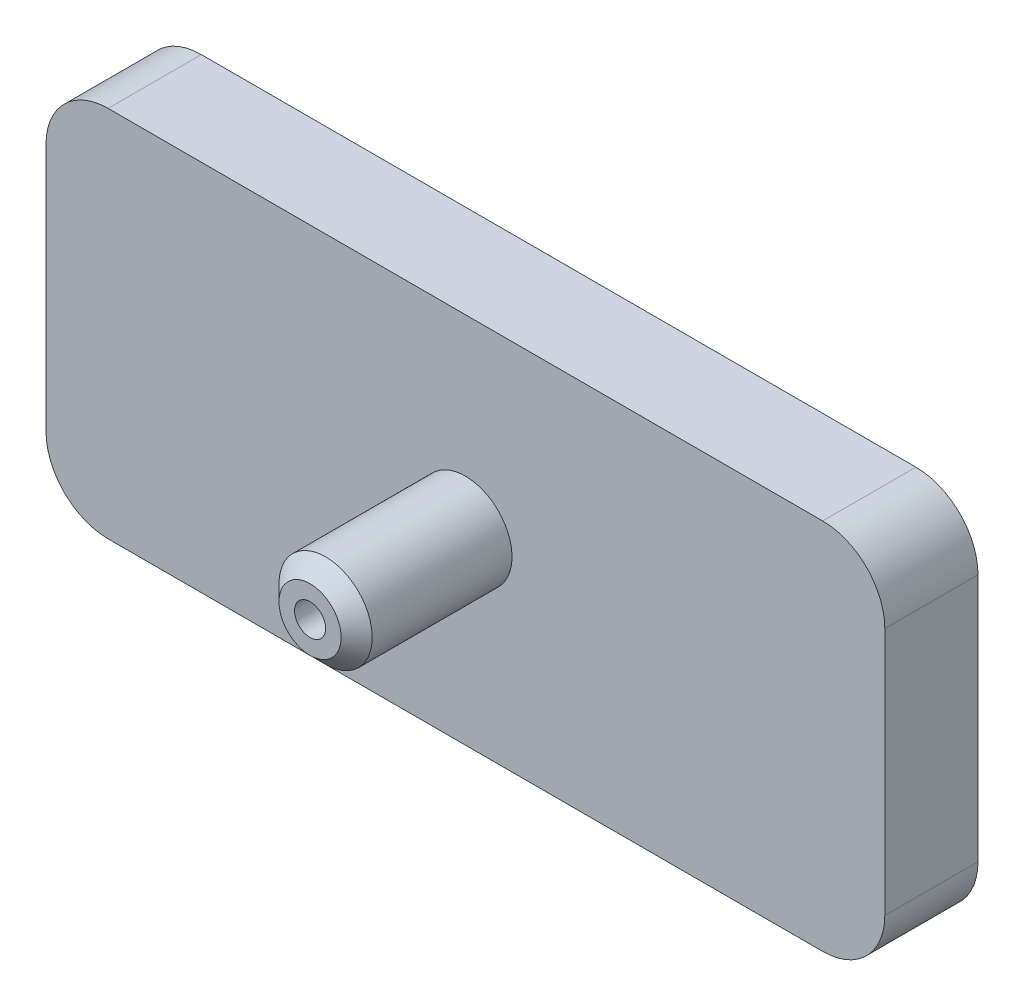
SolidWorks part; units mm, degrees
ref_plane "Plan de face" through (0, 0, 0) normal (0, 0, 1) x (1, 0, 0)
ref_plane "Plan de dessus" through (0, 0, 0) normal (0, 1, 0) x (1, 0, 0)
ref_plane "Plan de droite" through (0, 0, 0) normal (1, 0, 0) x (0, 0, -1)
sketch "Esquisse4" plane through (0, 0, 0) normal (0, 0, 1) x (1, 0, 0)
  line L1 (-11.5, -6) -> (11.5, -6)
  line L2 (-13.5, -4) -> (-13.5, 4)
  line L3 (-11.5, 6) -> (11.5, 6)
  line L4 (13.5, -4) -> (13.5, 4)
  line L5 (-13.5, -6) -> (13.5, 6) construction
  line L6 (-13.5, 6) -> (13.5, -6) construction
  arc A0 (-11.5, -6) -> (-13.5, -4) centre (-11.5, -4) cw
  arc A1 (11.5, -6) -> (13.5, -4) centre (11.5, -4) ccw
  arc A2 (11.5, 6) -> (13.5, 4) centre (11.5, 4) cw
  arc A3 (-13.5, 4) -> (-11.5, 6) centre (-11.5, 4) cw
  circle A4 centre (0, 0) radius 1
  point P0 (0, 0)
  dimension "D3" = 2
  dimension "D1" = 12
  dimension "D2" = 27
extrude "Boss.-Extru.3" add sketch "Esquisse4" along normal blind 3
sketch "Esquisse5" plane through (0, 0, 0) normal (0, 0, -1) x (-1, 0, 0)
  line L1 (-11.5, -5) -> (11.5, -5)
  line L2 (-12.5, -4) -> (-12.5, 4)
  line L3 (-11.5, 5) -> (11.5, 5)
  line L4 (12.5, -4) -> (12.5, 4)
  line L5 (-12.5, -5) -> (12.5, 5) construction
  line L6 (-12.5, 5) -> (12.5, -5) construction
  arc A0 (11.5, 5) -> (12.5, 4) centre (11.5, 4) cw
  arc A1 (11.5, -5) -> (12.5, -4) centre (11.5, -4) ccw
  arc A2 (-11.5, -5) -> (-12.5, -4) centre (-11.5, -4) cw
  arc A3 (-12.5, 4) -> (-11.5, 5) centre (-11.5, 4) cw
  point P0 (0, 0)
  dimension "D3" = 1
  dimension "D1" = 10
  dimension "D2" = 25
extrude "Enlèv. mat.-Extru.2" cut sketch "Esquisse5" against normal blind 2
sketch "Esquisse6" plane through (0, 0, 0) normal (1, 0, 0) x (0, 0, -1)
  line L0 (-3, 0.5) -> (-8, 0.5)
  line L1 (-8, 0.5) -> (-8, 1)
  line L2 (-8, 1) -> (-7.5, 1.5)
  line L3 (-7.5, 1.5) -> (-3, 1.5)
  line L4 (-3, -4) -> (-3, 4) construction
  line L5 (-3, 1.5) -> (-3, 0.5)
  line L6 (0, 0) -> (-13.125, 0) construction
  dimension "D1" = 5
  dimension "D2" = 1.5
  dimension "D3" = 0.5
  dimension "D4" = 4.5
  dimension "D5" = 0.5
revolve "Révolution1" add sketch "Esquisse6" angle 360 about L6
